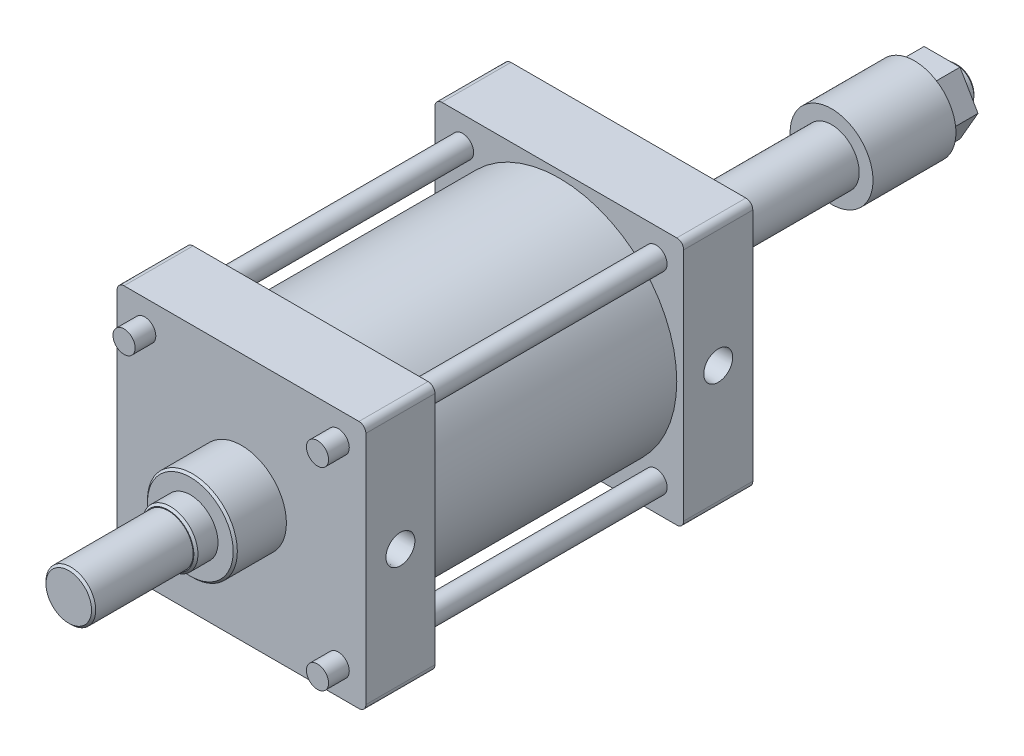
SolidWorks part; units mm, degrees
ref_plane "前视基准面" through (0, 0, 0) normal (0, 0, 1) x (1, 0, 0)
ref_plane "上视基准面" through (0, 0, 0) normal (0, 1, 0) x (1, 0, 0)
ref_plane "右视基准面" through (0, 0, 0) normal (1, 0, 0) x (0, 0, -1)
sketch "草图1" plane through (0, 0, 0) normal (0, 0, 1) x (1, 0, 0)
  line L0 (0, 0) -> (70, 0) construction
  line L1 (85, 90) -> (-85, 90)
  line L2 (90, 85) -> (90, -85)
  line L3 (85, -90) -> (-85, -90)
  line L4 (-90, 85) -> (-90, -85)
  line L5 (90, 90) -> (-90, -90) construction
  line L6 (90, -90) -> (-90, 90) construction
  line L7 (70, 0) -> (70, -70) construction
  arc A0 (-90, -85) -> (-85, -90) centre (-85, -85) ccw
  arc A1 (90, -85) -> (85, -90) centre (85, -85) cw
  arc A2 (85, 90) -> (90, 85) centre (85, 85) cw
  arc A3 (-85, 90) -> (-90, 85) centre (-85, 85) ccw
  circle A4 centre (70, -70) radius 8
  circle A5 centre (-70, -70) radius 8
  circle A6 centre (-70, 70) radius 8
  circle A7 centre (70, 70) radius 8
  point P0 (0, 0)
  point P31 (0, 0)
  dimension "D3" = 5
  dimension "D4" = 4
  dimension "D1" = 180
  dimension "D2" = 180
extrude "凸台-拉伸1" add sketch "草图1" along normal blind 50
sketch "草图2" plane through (0, 0, 0) normal (0, 0, -1) x (-1, 0, 0)
  circle A0 centre (0, 0) radius 85
extrude "凸台-拉伸2" add sketch "草图2" along normal blind 180
sketch "草图3" plane through (0, 0, -180) normal (0, 0, -1) x (-1, 0, 0)
  line L4 (90, -85) -> (90, 85)
  line L5 (85, 90) -> (-85, 90)
  line L6 (-90, 85) -> (-90, -85)
  line L7 (-85, -90) -> (85, -90)
  line L8 (90, -85) -> (90, 85)
  line L9 (85, 90) -> (-85, 90)
  line L10 (-90, 85) -> (-90, -85)
  line L11 (-85, -90) -> (85, -90)
  circle A0 centre (70, -70) radius 8 construction
  circle A1 centre (-70, -70) radius 8 construction
  circle A2 centre (70, 70) radius 8 construction
  circle A3 centre (-70, 70) radius 8 construction
  arc A4 (85, -90) -> (90, -85) centre (85, -85) ccw
  arc A5 (90, 85) -> (85, 90) centre (85, 85) ccw
  arc A6 (-85, 90) -> (-90, 85) centre (-85, 85) ccw
  arc A7 (-90, -85) -> (-85, -90) centre (-85, -85) ccw
  arc A8 (85, -90) -> (90, -85) centre (85, -85) ccw
  arc A9 (90, 85) -> (85, 90) centre (85, 85) ccw
  arc A10 (-85, 90) -> (-90, 85) centre (-85, 85) ccw
  arc A11 (-90, -85) -> (-85, -90) centre (-85, -85) ccw
  circle A12 centre (70, -70) radius 8
  circle A13 centre (-70, -70) radius 8
  circle A14 centre (70, 70) radius 8
  circle A15 centre (-70, 70) radius 8
  dimension "D1" = 0
extrude "凸台-拉伸3" add sketch "草图3" along normal blind 50
sketch "草图4" plane through (0, 0, 50) normal (0, 0, 1) x (1, 0, 0)
  circle A0 centre (0, 0) radius 32.5
extrude "凸台-拉伸4" add sketch "草图4" along normal blind 37
sketch "草图5" plane through (0, 0, -230) normal (0, 0, -1) x (-1, 0, 0)
  circle A0 centre (0, 0) radius 32.5
extrude "凸台-拉伸5" add sketch "草图5" along normal blind 37
sketch "草图6" plane through (0, 0, 87) normal (0, 0, 1) x (1, 0, 0)
  circle A0 centre (0, 0) radius 20
extrude "凸台-拉伸7" add sketch "草图6" along normal blind 16
sketch "草图7" plane through (0, 0, 103) normal (0, 0, 1) x (1, 0, 0)
  circle A0 centre (0, 0) radius 18
extrude "凸台-拉伸8" add sketch "草图7" along normal blind 72
chamfer "倒角1" distance 1.5 angle 45 3 edges at (18, 0, 175) (20, 0, 103) (32.5, 0, 87)
sketch "草图8" plane through (0, 0, -267) normal (0, 0, -1) x (-1, 0, 0)
  circle A0 centre (0, 0) radius 30
extrude "凸台-拉伸9" add sketch "草图8" along normal blind 10
sketch "草图9" plane through (0, 0, -277) normal (0, 0, -1) x (-1, 0, 0)
  circle A0 centre (0, 0) radius 20
extrude "凸台-拉伸10" add sketch "草图9" along normal blind 100
sketch "草图10" plane through (0, 0, -377) normal (0, 0, -1) x (-1, 0, 0)
  circle A0 centre (0, 0) radius 30
extrude "凸台-拉伸11" add sketch "草图10" along normal blind 60
sketch "草图11" plane through (0, 0, -437) normal (0, 0, -1) x (-1, 0, 0)
  line L1 (-25.9808, 0) -> (-12.9904, -22.5)
  line L2 (-12.9904, -22.5) -> (12.9904, -22.5)
  line L3 (12.9904, -22.5) -> (25.9808, 0)
  line L4 (25.9808, 0) -> (12.9904, 22.5)
  line L5 (12.9904, 22.5) -> (-12.9904, 22.5)
  line L6 (-12.9904, 22.5) -> (-25.9808, 0)
  circle A0 centre (0, 0) radius 22.5 construction
extrude "凸台-拉伸12" add sketch "草图11" along normal blind 20
sketch "草图12" plane through (0, 0, -457) normal (0, 0, -1) x (-1, 0, 0)
  circle A0 centre (0, 0) radius 13.5
extrude "凸台-拉伸13" add sketch "草图12" along normal blind 11
chamfer "倒角2" distance 1.5 angle 45 1 edges at (-13.5, 0, -468)
sketch "草图13" plane through (0, 0, 50) normal (0, 0, 1) x (1, 0, 0)
  circle A0 centre (70, -70) radius 8 construction
  circle A1 centre (-70, -70) radius 8 construction
  circle A2 centre (-70, 70) radius 8 construction
  circle A3 centre (70, 70) radius 8 construction
  circle A4 centre (70, -70) radius 8
  circle A5 centre (-70, -70) radius 8
  circle A6 centre (-70, 70) radius 8
  circle A7 centre (70, 70) radius 8
extrude "凸台-拉伸14" add sketch "草图13" along normal blind 15 and the other way up to surface (280 mm away) separate body
hole_wizard "1/2 Rc 螺纹孔1" positions "草图14" profile "草图15" size "1/2" standard "ISO"
sketch "草图14" plane through (90, 0, 0) normal (1, 0, 0) x (0, 0, -1)
  line L0 (-50, -85) -> (-50, 85) construction
  line L1 (180, 85) -> (180, -85) construction
  point P0 (-25, 0)
  point P2 (205, 0)
  dimension "D1" = 25
  dimension "D2" = 25
sketch "草图15" plane through (90, 0, 25) normal (0, 1, 0) x (0, 0, -1)
  line L0 (0, 0) -> (0, 29.3275)
  line L1 (8.75, 24.07) -> (0, 29.3275)
  line L2 (-8.75, 24.07) -> (0, 29.3275) construction
  line L3 (8.75, 24.07) -> (8.75, 15)
  line L4 (8.75, 15) -> (10.0093, 15)
  line L5 (10.0093, 15) -> (10.4775, 0)
  line L6 (-10.0093, 15) -> (-10.4775, 0) construction
  line L7 (10.4775, 0) -> (0, 0)
  line L8 (0, -6.35) -> (0, 107.95) construction
  line L11 (-8.75, 15) -> (-10.0093, 15) construction
  dimension "螺纹孔钻头直径" = 17.5
  dimension "螺纹孔钻头深度" = 24.07
  dimension "螺纹直径" = 20.955
  dimension "螺纹角度" = 3.576
  dimension "螺纹深度" = 15
  dimension "导头角度" = 118
